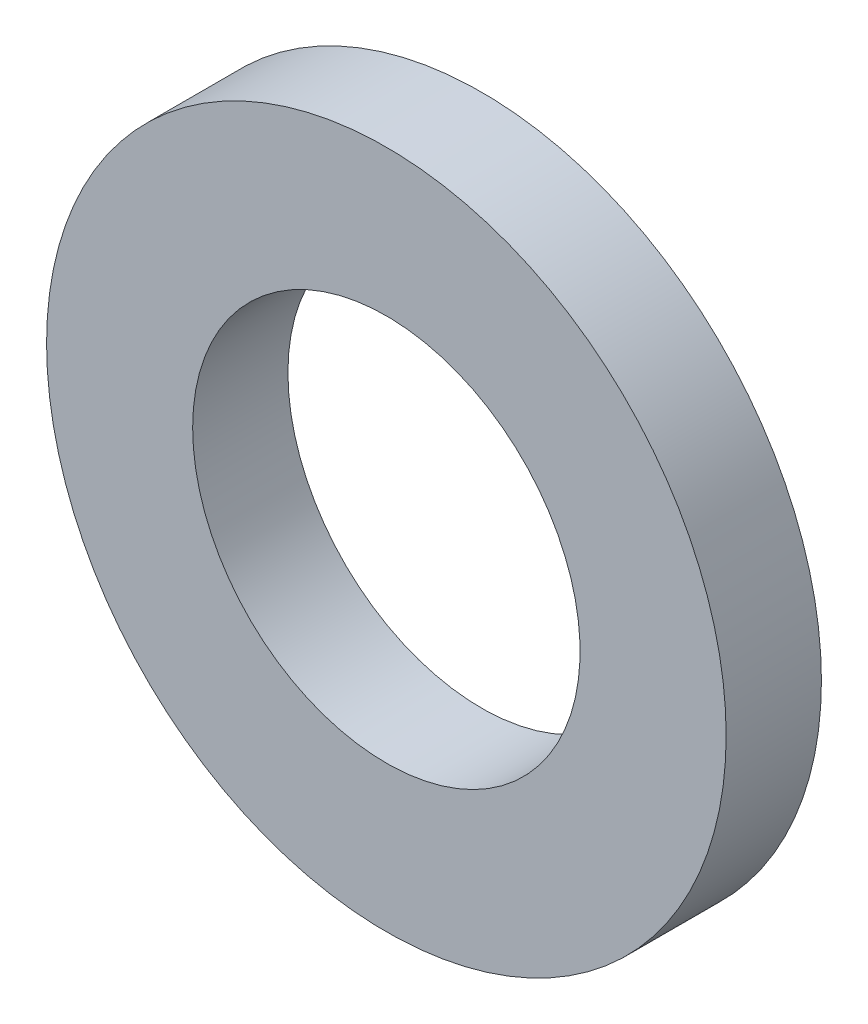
SolidWorks part; units mm, degrees
ref_plane "Front" through (0, 0, 0) normal (0, 0, 1) x (1, 0, 0)
ref_plane "Top" through (0, 0, 0) normal (0, 1, 0) x (1, 0, 0)
ref_plane "Right" through (0, 0, 0) normal (1, 0, 0) x (0, 0, -1)
sketch "Sketch1" plane through (0, 0, 0) normal (0, 0, 1) x (1, 0, 0)
  circle A0 centre (0, 0) radius 3.05
  circle A1 centre (0, 0) radius 5.35
  dimension "D1" = 6.1
  dimension "D2" = 10.7
extrude "Base-Extrude" add sketch "Sketch1" along normal blind 1.5
